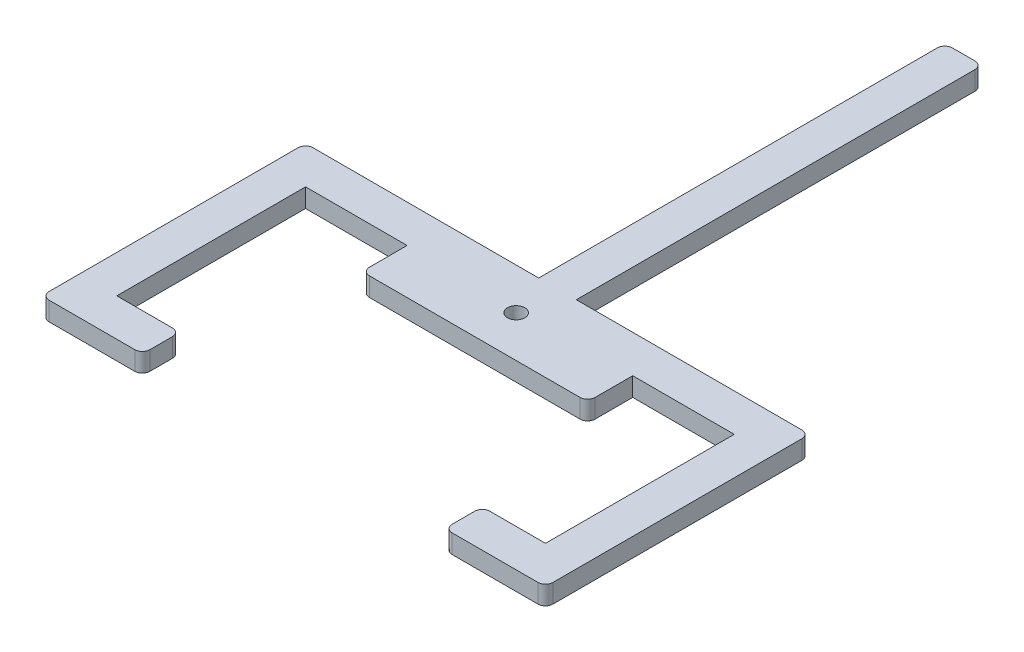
SolidWorks part; units mm, degrees
ref_plane "Front Plane" through (0, 0, 0) normal (0, 0, 1) x (1, 0, 0)
ref_plane "Top Plane" through (0, 0, 0) normal (0, 1, 0) x (1, 0, 0)
ref_plane "Right Plane" through (0, 0, 0) normal (1, 0, 0) x (0, 0, -1)
sketch "Sketch1" plane through (0, 0, 0) normal (0, 1, 0) x (1, 0, 0)
  line L0 (0, 0) -> (0, -68.58)
  line L1 (0, -79.375) -> (-15.875, -79.375)
  line L2 (-39.37, -68.58) -> (-39.37, -109.982)
  line L3 (-39.37, -109.982) -> (-33.02, -109.982)
  line L4 (6.35, -74.93) -> (6.35, -79.375)
  line L5 (-15.875, -82.55) -> (22.225, -82.55)
  line L6 (39.37, -74.93) -> (39.37, -109.982)
  line L7 (39.37, -109.982) -> (45.72, -109.982)
  line L8 (45.72, -68.58) -> (45.72, -109.982)
  line L9 (22.225, -79.375) -> (6.35, -79.375)
  line L10 (0, -74.93) -> (6.35, -74.93) construction
  line L11 (6.35, 0) -> (0, 0)
  line L12 (0, -74.93) -> (-33.02, -74.93)
  line L13 (-33.02, -74.93) -> (-33.02, -109.982)
  line L14 (0, -68.58) -> (-39.37, -68.58)
  line L15 (3.175, -74.93) -> (3.175, -68.58) construction
  line L16 (-15.875, -79.375) -> (-15.875, -82.55)
  line L17 (0, -79.375) -> (0, -74.93)
  line L18 (22.225, -79.375) -> (22.225, -82.55)
  line L19 (6.35, -68.58) -> (45.72, -68.58)
  line L20 (6.35, -68.58) -> (0, -68.58) construction
  line L22 (39.37, -74.93) -> (6.35, -74.93)
  line L23 (6.35, -68.58) -> (6.35, 0)
  point P13 (3.175, -82.55)
  dimension "D2" = 6.35
  dimension "D3" = 6.35
  dimension "D4" = 3.175
  dimension "D5" = 72.39
  dimension "D6" = 41.402
  dimension "D7" = 6.35
  dimension "D8" = 6.35
  dimension "D9" = 38.1
  dimension "D10" = 41.402
  dimension "D11" = 68.58
  dimension "D12" = 4.445
  dimension "D13" = 6.35
extrude "Boss-Extrude1" add sketch "Sketch1" along normal blind 3.175
sketch "Sketch2" plane through (0, 0, 0) normal (0, 1, 0) x (1, 0, 0)
  line L0 (-39.37, -68.58) -> (-39.37, -109.982) construction
  line L1 (-39.37, -106.807) -> (-22.352, -106.807)
  line L2 (-39.37, -106.807) -> (-39.37, -113.157)
  line L3 (-39.37, -113.157) -> (-22.352, -113.157)
  line L4 (-22.352, -106.807) -> (-22.352, -113.157)
  line L5 (-39.37, -109.982) -> (-33.02, -109.982) construction
  line L6 (3.175, 0) -> (3.175, -111.8396) construction
  line L7 (6.35, 0) -> (0, 0) construction
  line L8 (28.702, -106.807) -> (28.702, -113.157)
  line L9 (45.72, -113.157) -> (28.702, -113.157)
  line L10 (45.72, -106.807) -> (45.72, -113.157)
  line L11 (45.72, -106.807) -> (28.702, -106.807)
  point P6 (-39.37, -109.982)
  dimension "D1" = 6.35
  dimension "D2" = 17.018
extrude "Boss-Extrude2" add sketch "Sketch2" along normal blind 3.175
hole_wizard "#4 Clearance Hole1" positions "Sketch4" profile "Sketch3" hole size "#4" standard "ANSI Inch"
sketch "Sketch4" plane through (0, 3.175, 0) normal (0, 1, 0) x (1, 0, 0)
  line L1 (-15.875, -82.55) -> (22.225, -82.55) construction
  line L3 (8.2015, -68.58) -> (8.2015, -82.55) construction
  line L4 (45.72, -68.58) -> (6.35, -68.58) construction
  point P0 (3.175, -75.565)
  point P11 (3.175, -82.55)
  point P22 (8.2015, -75.565)
sketch "Sketch3" plane through (3.175, 3.175, 75.565) normal (1, 0, 0) x (0, 0, 1)
  line L0 (0, 0) -> (0, 3.175)
  line L1 (0, 3.175) -> (1.4732, 3.175)
  line L2 (1.4732, 3.175) -> (1.4732, 0)
  line L5 (1.4732, 0) -> (0, 0)
  line L11 (0, -6.35) -> (0, 107.95) construction
  dimension "Thru Hole Dia." = 2.9464
  dimension "Thru Hole Depth" = 3.175
sketch "Sketch5" plane through (0, 0, 0) normal (0, 1, 0) x (1, 0, 0)
  line L1 (0, -74.93) -> (-15.875, -74.93)
  line L2 (0, -74.93) -> (0, -79.375)
  line L3 (0, -79.375) -> (-15.875, -79.375)
  line L4 (-15.875, -74.93) -> (-15.875, -79.375)
  line L5 (6.35, -74.93) -> (22.225, -74.93)
  line L6 (6.35, -74.93) -> (6.35, -79.375)
  line L7 (6.35, -79.375) -> (22.225, -79.375)
  line L8 (22.225, -74.93) -> (22.225, -79.375)
extrude "Boss-Extrude3" add sketch "Sketch5" along normal blind 3.175
fillet "Fillet1" radius 1.27 12 edges at (-15.875, 1.5875, 82.55) (22.225, 1.5875, 82.55) (45.72, 1.5875, 113.157) (-22.352, 1.5875, 113.157) (-22.352, 1.5875, 106.807) (-39.37, 1.5875, 113.157) (28.702, 1.5875, 113.157) (28.702, 1.5875, 106.807) (45.72, 1.5875, 68.58) (-39.37, 1.5875, 68.58) (6.35, 1.5875, 0) (0, 1.5875, 0)
